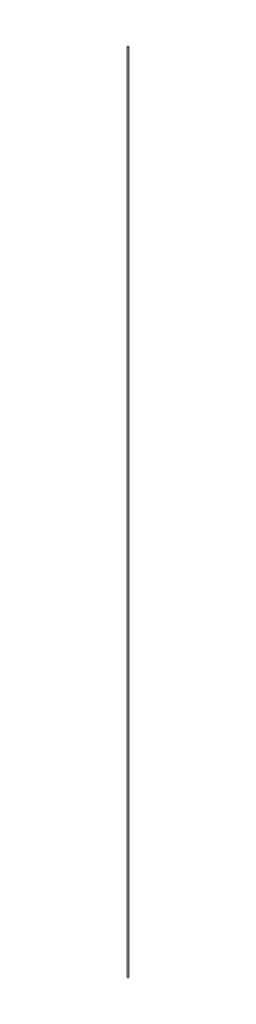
SolidWorks part; units mm, degrees
ref_plane "Plan de face" through (0, 0, 0) normal (0, 0, 1) x (1, 0, 0)
ref_plane "Plan de dessus" through (0, 0, 0) normal (0, 1, 0) x (1, 0, 0)
ref_plane "Plan de droite" through (0, 0, 0) normal (1, 0, 0) x (0, 0, -1)
sketch "Esquisse1" plane through (0, 0, 0) normal (0, 1, 0) x (1, 0, 0)
  circle A0 centre (0, 0) radius 0.15
  dimension "D1" = 0.3
extrude "Boss.-Extru.1" add sketch "Esquisse1" along normal blind 200
